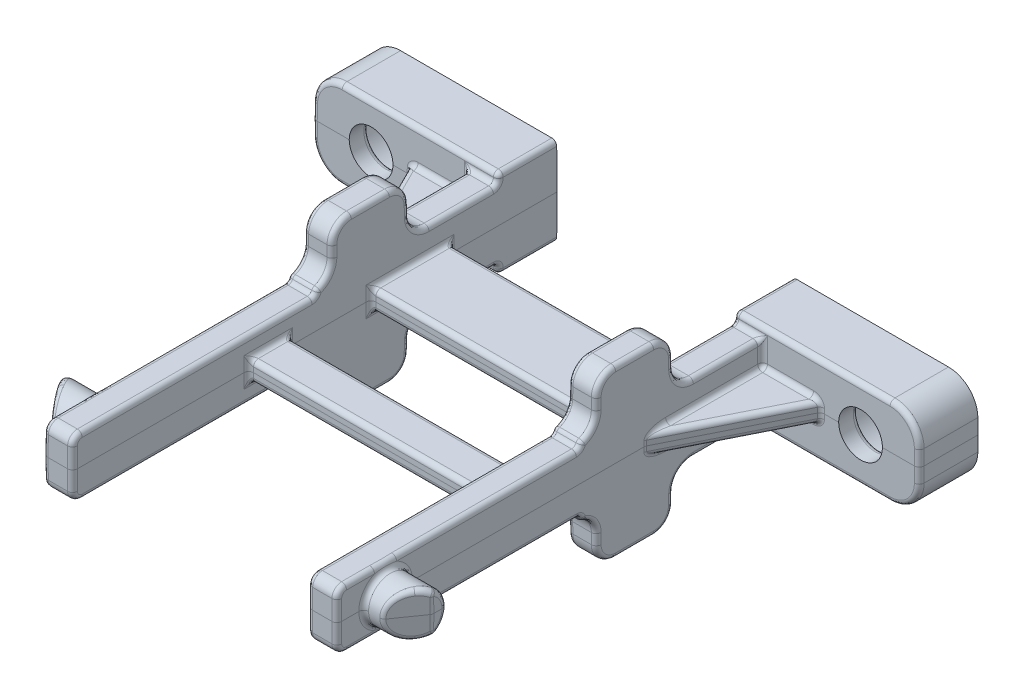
SolidWorks part; units mm, degrees
ref_plane "Plan de face" through (0, 0, 0) normal (0, 0, 1) x (1, 0, 0)
ref_plane "Plan de dessus" through (0, 0, 0) normal (0, 1, 0) x (1, 0, 0)
ref_plane "Plan de droite" through (0, 0, 0) normal (1, 0, 0) x (0, 0, -1)
imported_body "Importée1"
fillet "Congé1" radius 0.5
fillet "Congé2" radius 0.5 14 edges at (0, -1, 18.9913) (-12.0087, -1, 29.5) (12.0087, -1, 29.5) (-28.75, 0, 4) (-25, 2.25, 4) (0, -1, 11.0087)
fillet "Congé3" radius 0.5 83 edges at (-11.8623, 1, 27.3623) (11.8623, 1, 27.3623) (12.0087, 1, 29.5) (12.0088, -1.0044, 49.4912) (12.0262, -3, 36.7413) (12.0375, -4.2994, 23.3153) (12.0691, -7.9204, 22.3512) (12.0742, -8.5, 19) (12.0691, -7.9204, 15.6488) (12.0356, -4.0796, 14.456) (12.0305, -3.5, 9.5087) (12.0305, 3.5, 9.5087) (12.0356, 4.0796, 14.456) (12.0691, 7.9204, 15.6488) (12.0742, 8.5, 19) (12.0691, 7.9204, 22.3512) (12.0375, 4.2994, 23.3153) (12.0262, 3, 36.7413) (12.0088, 1.0044, 49.4912) (14.9912, -1.0044, 49.4912) (14.9738, -3, 36.7413) (14.9625, -4.2994, 23.3153) (14.9309, -7.9204, 22.3512) (14.9258, -8.5, 19) (14.9309, -7.9204, 15.6488) (14.9644, -4.0796, 14.456) (13.5, -3.5, 5.9695) (14.9695, -3.5, 9.5087) (-12.0087, 1, 29.5) (13.5, 3.5, 5.9695) (14.9912, 1.0044, 49.4912) (12.0237, -2.7102, 49.1865) (14.9763, -2.7102, 49.1865) (14.9697, -3.4672, 24.4259) (14.9731, -3.0824, 24.725) (14.9804, -2.25, 5.9804) (14.9476, -6, 15.0524) (14.9479, -5.9741, 22.9479) (12.0269, -3.0824, 24.725) (12.0303, -3.4672, 24.4259) (12.0521, -5.9741, 22.9479) (12.0524, -6, 15.0524) (12.0349, -4, 5.9651) (21.25, 0, 4) (14.9804, 2.25, 5.9804) (12.0349, 4, 5.9651) (12.0524, 6, 15.0524) (12.0521, 5.9741, 22.9479) (12.0303, 3.4672, 24.4259) (12.0237, 2.7102, 49.1865) (12.0269, 3.0824, 24.725) (0, -1, 31.4913) (0, -1, 27.5087)
fillet "Congé4" radius 0.5 12 edges at (0, 1, 27.5087) (-12.0087, 1, 15) (12.0087, 1, 15) (0, 1, 31.4913)
fillet "Congé5" radius 0.5 88 edges at (0, 1, 18.9913) (-12.0088, 1.0044, 49.4912) (-12.0237, 2.7102, 49.1865) (-12.0262, 3, 36.7413) (-12.0269, 3.0824, 24.725) (-12.0303, 3.4672, 24.4259) (-12.0375, 4.2994, 23.3153) (-12.0521, 5.9741, 22.9479) (-12.0691, 7.9204, 22.3512) (-12.0742, 8.5, 19) (-12.0691, 7.9204, 15.6488) (-12.0524, 6, 15.0524) (-12.0356, 4.0796, 14.456) (-12.0305, 3.5, 9.5087) (-20.9973, -0.5, 5.9956) (-14.9956, 0.5, 17.999) (14.9804, 2.25, 44.5) (-12.0088, -1.0044, 49.4912) (-12.0237, -2.7102, 49.1865) (-12.0262, -3, 36.7413) (-12.0269, -3.0824, 24.725) (-12.0303, -3.4672, 24.4259) (-12.0375, -4.2994, 23.3153) (-12.0521, -5.9741, 22.9479) (-12.0691, -7.9204, 22.3512) (-12.0742, -8.5, 19) (-12.0691, -7.9204, 15.6488) (-12.0524, -6, 15.0524) (-12.0356, -4.0796, 14.456) (-30.9933, 0.7631, 5.9933) (-30.0988, 3.6306, 5.9683) (-14.9695, -3.5, 9.5087) (-14.9644, -4.0796, 14.456) (-14.9476, -6, 15.0524) (-14.9309, -7.9204, 15.6488) (-14.9258, -8.5, 19) (-14.9309, -7.9204, 22.3512) (-14.9479, -5.9741, 22.9479) (-14.9625, -4.2994, 23.3153) (-14.9697, -3.4672, 24.4259) (-14.9731, -3.0824, 24.725) (-14.9912, -1.0044, 49.4912) (-14.9763, -2.7102, 49.1865) (-19, 0, 5) (-16.7728, 2.5, 5) (-13.9782, 2.5218, 2.5) (-14, 0, 5) (-13.9782, -2.5218, 2.5) (-16.7728, -2.5, 5) (13.9782, 2.5218, 2.5) (14, 0, 5) (16.7728, 2.5, 5) (19, 0, 5) (16.7728, -2.5, 5) (13.9782, -2.5218, 2.5) (14.9804, -2.25, 44.5) (-12.0393, -4.5, 2.9804) (-12.0393, 4.5, 2.9804) (-12.0305, -3.5, 9.5087) (-13.5, 3.5, 5.9695) (-12.0349, 4, 5.9651) (-20.013, 4.5, 5.9607) (-12.0349, -4, 5.9651) (-13.5, -3.5, 5.9695) (-14.9804, -2.25, 5.9804) (-14.9913, -1, 11.9946) (-17.9929, -1, 5.9913) (-17.9929, 1, 5.9913) (-17.9929, 1, 11.9946) (-20.9973, 0.5, 5.9956) (-17.9929, -1, 11.9946) (-14.9956, -0.5, 17.999) (-14.9913, 1, 11.9946) (-14.9804, 2.25, 5.9804) (-14.9738, -3, 36.7413) (0, 1, 11.0087)
fillet "Congé6" radius 0.5 35 edges at (-14.9746, 2.9111, 48.8947) (-15.1162, 3.6449, 6.1131) (-14.9695, 3.5, 6.4673) (-14.9695, 3.5, 9.7587) (-14.9644, 4.0796, 14.456) (-14.9476, 6, 15.0524) (-14.9309, 7.9204, 15.6488) (-14.9258, 8.5, 19) (-14.9309, 7.9204, 22.3512) (-14.9479, 5.9741, 22.9479) (-14.9625, 4.2994, 23.3153) (-14.9697, 3.4672, 24.4259) (-14.9731, 3.0824, 24.725) (15.1162, 3.6449, 6.1131) (14.9695, 3.5, 6.4673) (14.9695, 3.5, 9.7587) (14.9644, 4.0796, 14.456) (14.9476, 6, 15.0524) (14.9309, 7.9204, 15.6488) (14.9258, 8.5, 19) (14.9309, 7.9204, 22.3512) (14.9479, 5.9741, 22.9479) (14.9625, 4.2994, 23.3153) (14.9697, 3.4672, 24.4259) (14.9731, 3.0824, 24.725) (14.9746, 2.9111, 48.8947) (12.1829, -4.3551, 5.814) (-12.1829, -4.3551, 5.814) (-29.6292, -4.0105, 5.965) (-14.9738, 3, 36.7413) (14.9738, 3, 36.7413) (20.263, -4.5, 5.9607) (-20.263, -4.5, 5.9607)
fillet "Congé7" radius 0.5 3 edges at (12.1829, 4.3551, 5.814) (29.6292, 4.0105, 5.965) (20.263, 4.5, 5.9607)
